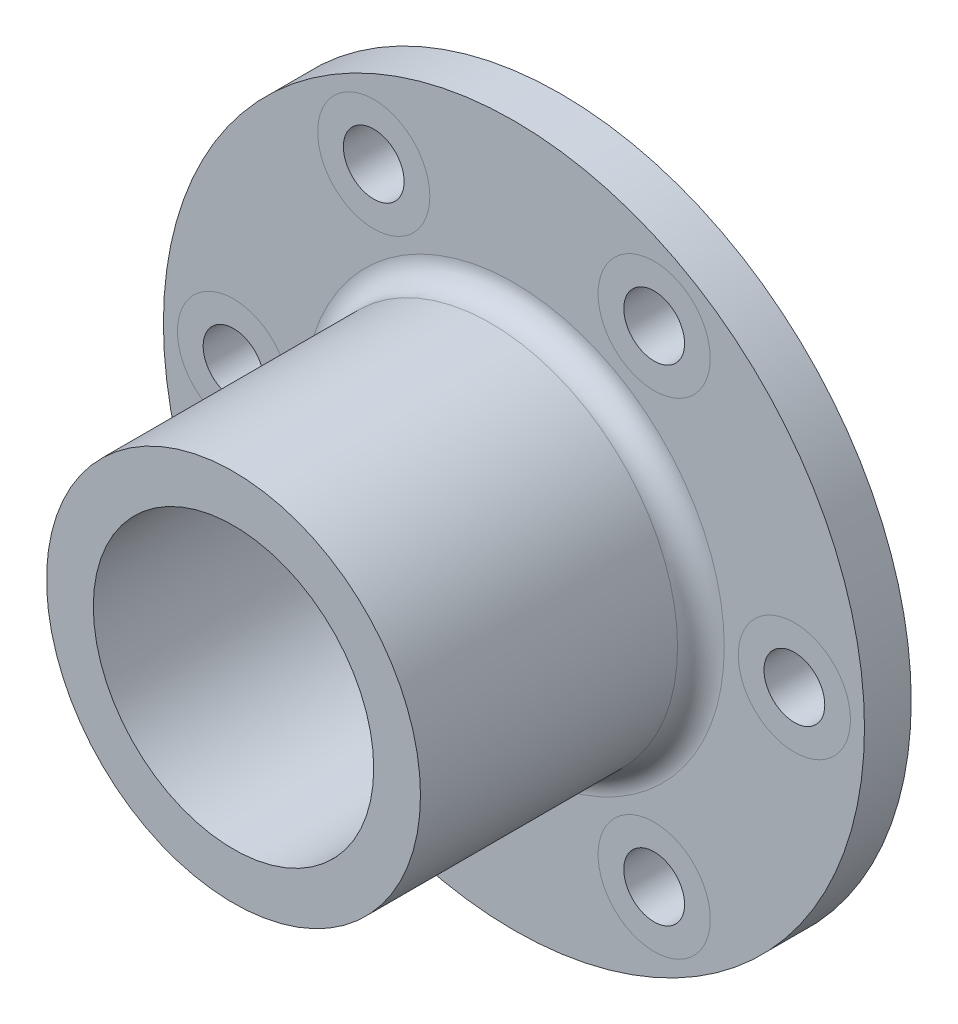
SolidWorks part; units mm, degrees
ref_plane "Front Plane" through (0, 0, 0) normal (0, 0, 1) x (1, 0, 0)
ref_plane "Top Plane" through (0, 0, 0) normal (0, 1, 0) x (1, 0, 0)
ref_plane "Right Plane" through (0, 0, 0) normal (1, 0, 0) x (0, 0, -1)
sketch "Sketch1" plane through (0, 0, 0) normal (0, 0, 1) x (1, 0, 0)
  circle A0 centre (0, 0) radius 75
  dimension "D1" = 150
extrude "Extrude1" add sketch "Sketch1" along normal blind 10
sketch "Sketch2" plane through (0, 0, 10) normal (0, 0, 1) x (1, 0, 0)
  circle A0 centre (0, 0) radius 40
  dimension "D1" = 80
extrude "Extrude2" add sketch "Sketch2" along normal blind 60
sketch "Sketch3" plane through (0, 0, 70) normal (0, 0, 1) x (1, 0, 0)
  circle A0 centre (0, 0) radius 30
  dimension "D1" = 60
extrude "Cut-Extrude1" cut sketch "Sketch3" against normal through all
fillet "Fillet1" radius 5 1 edges at (40, 0, 10)
sketch "Sketch4" plane through (0, 0, 0) normal (0, 0, -1) x (-1, 0, 0)
  line L0 (0, 0) -> (105.4094, 0) construction
  circle A0 centre (0, 0) radius 60 construction
  circle A2 centre (60, 0) radius 6.5
  dimension "D1" = 120
  dimension "D2" = 13
extrude "Cut-Extrude2" cut sketch "Sketch4" against normal through all
pattern_circular "CirPattern1" count 6 over 360 about axis through (0, 0, 0) along (0, 0, 1) of "Cut-Extrude2", "Cut-Extrude1"
sketch "Sketch5" plane through (0, 0, 10) normal (0, 0, 1) x (1, 0, 0)
  circle A0 centre (-30, -51.9615) radius 12
  circle A1 centre (-30, -51.9615) radius 6.5 construction
  dimension "D1" = 24
sketch "Sketch6" plane through (0, 0, 10) normal (0, 0, 1) x (1, 0, 0)
  circle A0 centre (30, -51.9615) radius 12
  circle A1 centre (30, -51.9615) radius 6.5 construction
  dimension "D1" = 24
sketch "Sketch7" plane through (0, 0, 10) normal (0, 0, 1) x (1, 0, 0)
  circle A0 centre (60, 0) radius 12
  circle A1 centre (60, 0) radius 6.5 construction
  dimension "D1" = 24
sketch "Sketch8" plane through (0, 0, 10) normal (0, 0, 1) x (1, 0, 0)
  circle A0 centre (30, 51.9615) radius 12
  circle A1 centre (30, 51.9615) radius 6.5 construction
  dimension "D1" = 24
sketch "Sketch9" plane through (0, 0, 10) normal (0, 0, 1) x (1, 0, 0)
  circle A0 centre (-30, 51.9615) radius 12
  circle A1 centre (-30, 51.9615) radius 6.5 construction
  dimension "D1" = 24
sketch "Sketch10" plane through (0, 0, 10) normal (0, 0, 1) x (1, 0, 0)
  circle A0 centre (-60, 0) radius 12
  circle A1 centre (-60, 0) radius 6.5 construction
  dimension "D1" = 24
